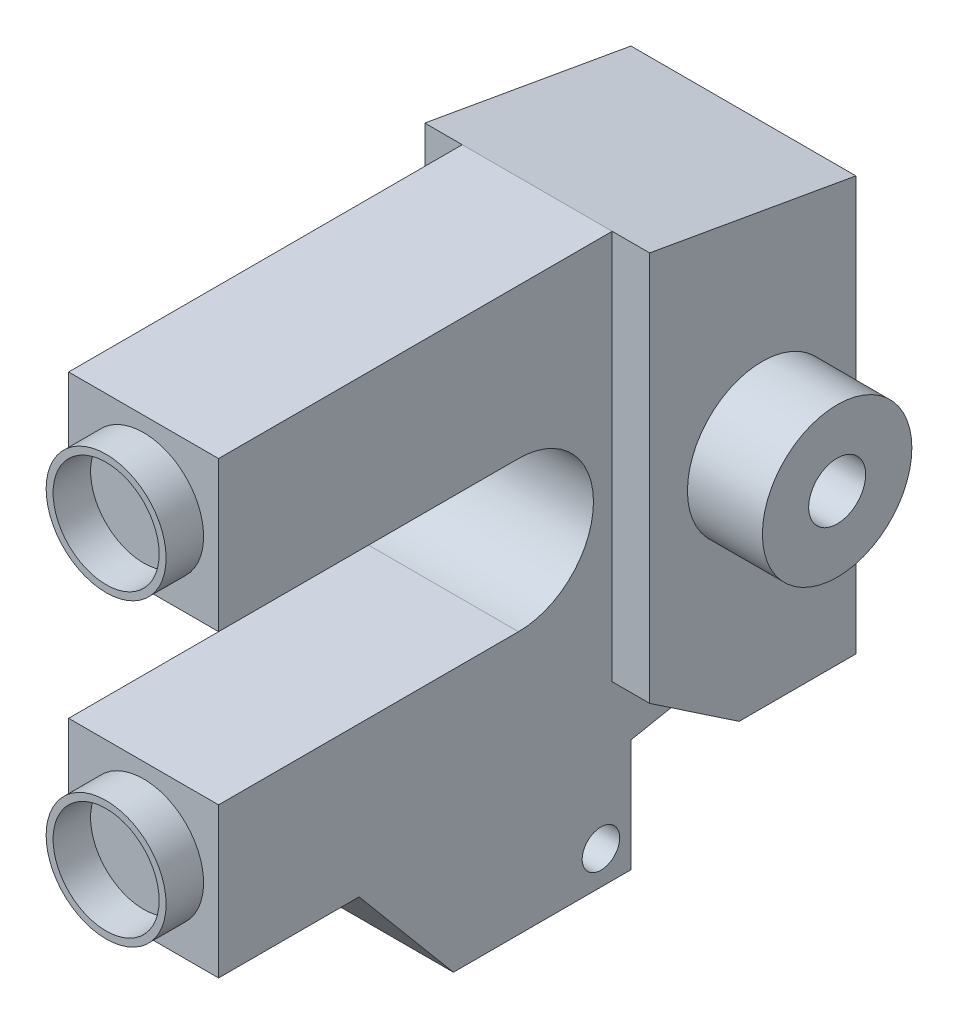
SolidWorks part; units mm, degrees
ref_plane "Front" through (0, 0, 0) normal (0, 0, 1) x (1, 0, 0)
ref_plane "Top" through (0, 0, 0) normal (0, 1, 0) x (1, 0, 0)
ref_plane "Right" through (0, 0, 0) normal (1, 0, 0) x (0, 0, -1)
sketch "Sketch1" plane through (0, 0, 0) normal (1, 0, 0) x (0, 0, -1)
  line L0 (0, 0) -> (0, 38.1)
  line L1 (0, 38.1) -> (33.3375, 38.1)
  line L2 (33.3375, 38.1) -> (50.8, 35.0209)
  line L3 (50.8, 35.0209) -> (50.8, 3.0858)
  line L4 (50.8, 3.0858) -> (34.925, 0)
  line L5 (34.925, 0) -> (34.925, -9.525)
  line L6 (34.925, -9.525) -> (19.89, -9.525)
  line L7 (19.89, -9.525) -> (11.8975, 0)
  line L8 (11.8975, 0) -> (0, 0)
  dimension "D1" = 33.3375
  dimension "D2" = 17.4625
  dimension "D3" = 50
  dimension "D4" = 9.525
  dimension "D5" = 34.925
  dimension "D6" = 38.1
  dimension "D7" = 11
  dimension "D8" = 10
  dimension "D9" = 11.8975
extrude "Boss-Extrude1" add sketch "Sketch1" along normal mid plane 12.7
sketch "Sketch2" plane through (6.35, 0, 0) normal (1, 0, 0) x (0, 0, -1)
  line L0 (0, 19.05) -> (25.4, 19.05) construction
  line L1 (0, 38.1) -> (0, 0) construction
  line L2 (0, 25.4) -> (25.4, 25.4)
  line L3 (0, 12.7) -> (25.4, 12.7)
  line L4 (33.3375, 38.1) -> (0, 38.1) construction
  arc A0 (0, 25.4) -> (0, 12.7) centre (0, 19.05) ccw
  arc A1 (25.4, 12.7) -> (25.4, 25.4) centre (25.4, 19.05) ccw
  point P4 (12.7, 19.05)
  dimension "D2" = 9.525
  dimension "D1" = 12.7
extrude "Cut-Extrude1" cut sketch "Sketch2" against normal through all
ref_plane "Plane1" through (6.35, 0, 0) normal (1, 0, 0) x (0, 0, -1)
sketch "Sketch3" plane through (6.35, 0, 0) normal (1, 0, 0) x (0, 0, -1)
  line L0 (33.3375, 38.1) -> (33.3375, 5.0603)
  line L1 (33.3375, 5.0603) -> (40.9066, -0.0452)
  line L2 (40.9066, -0.0452) -> (50.8, -0.0452)
  line L3 (50.8, 35.0209) -> (50.8, -0.0452)
  line L9 (33.3375, 38.1) -> (50.8, 35.0209)
  line L11 (33.3375, 38.1) -> (0, 38.1) construction
  line L12 (50.8, 3.0858) -> (50.8, 35.0209) construction
  line L13 (-967.616, -7.0741) -> (33.9715, -7.0741) construction
  line L15 (99.3934, -7.0741) -> (106.2938, -7.0741) construction
  circle A2 centre (32.384, -7.0741) radius 1.5875 construction
  circle A3 centre (102.8436, -6.698) radius 3.4706 construction
  point P18 (50.8, 25.4)
  point P21 (100.6665, 6.002)
  dimension "D6" = 34
  dimension "D3" = 10
  dimension "D4" = 40.9066
  dimension "D13" = 3.175
  dimension "D10" = 6.9412
  dimension "D9" = 70.4596
extrude "Boss-Extrude2" add sketch "Sketch3" along normal blind 3.175
sketch "Sketch4" plane through (9.525, 0, 0) normal (1, 0, 0) x (0, 0, -1)
  circle A0 centre (42.8625, 19.05) radius 6.3287
  dimension "D2" = 12.6574
  dimension "D1" = 17.4625
extrude "Boss-Extrude3" add sketch "Sketch4" along normal blind 6.35
ref_plane "Plane2" through (0, 0, 0) normal (-1, 0, 0) x (0, 0, 1)
mirror "Mirror1" about plane through (0, 0, 0) normal (-1, 0, 0) of "Boss-Extrude2"
sketch "Sketch8" plane through (-9.525, 0, 0) normal (-1, 0, 0) x (0, 0, 1)
  circle A0 centre (-42.8625, 19.05) radius 6.35
  dimension "D1" = 12.7
extrude "Boss-Extrude5" add sketch "Sketch8" along normal blind 6.35
sketch "Sketch9" plane through (-15.875, 0, 0) normal (-1, 0, 0) x (0, 0, 1)
  circle A0 centre (-42.8625, 19.05) radius 2.413
  dimension "D1" = 4.826
extrude "Cut-Extrude4" cut sketch "Sketch9" against normal through all
sketch "Sketch12" plane through (0, -9.525, 0) normal (0, -1, 0) x (1, 0, 0)
  line L0 (6.35, -34.925) -> (-6.35, -34.925) construction
  line L1 (-3.175, -34.925) -> (3.175, -34.925)
  line L2 (-3.175, -34.925) -> (-3.175, -22.225)
  line L3 (-3.175, -22.225) -> (3.175, -22.225)
  line L4 (3.175, -34.925) -> (3.175, -22.225)
  line L5 (-3.175, -34.925) -> (3.175, -22.225) construction
  line L6 (-3.175, -22.225) -> (3.175, -34.925) construction
  point P0 (0, -28.575)
  dimension "D1" = 12.7
  dimension "D2" = 6.35
  dimension "D3" = 0
extrude "Cut-Extrude5" cut sketch "Sketch12" against normal blind 11.1125
sketch "Sketch14" plane through (6.35, 0, 0) normal (1, 0, 0) x (0, 0, -1)
  line L0 (34.925, -9.525) -> (34.925, 0) construction
  line L2 (19.89, -9.525) -> (34.925, -9.525) construction
  circle A0 centre (32.384, -6.698) radius 1.5875
  dimension "D2" = 3.175
  dimension "D3" = 2.827
  dimension "D1" = 2.541
extrude "Cut-Extrude6" cut sketch "Sketch14" against normal through all
sketch "Sketch15" plane through (0, 0, 0) normal (0, 0, 1) x (1, 0, 0)
  line L0 (6.35, 38.1) -> (6.35, 25.4) construction
  line L1 (-6.35, 25.4) -> (6.35, 25.4) construction
  circle A0 centre (0, 31.75) radius 4.4907
  circle A1 centre (0, 31.75) radius 5.08
  dimension "D1" = 8.9814
  dimension "D2" = 10.16
  dimension "D4" = 6.35
  dimension "D3" = 6.35
extrude "Boss-Extrude6" add sketch "Sketch15" along normal blind 3.175
sketch "Sketch16" plane through (0, 0, 0) normal (0, 0, 1) x (1, 0, 0)
  line L0 (6.35, 0) -> (-6.35, 0) construction
  line L1 (-6.35, 12.7) -> (-6.35, 0) construction
  circle A0 centre (0, 6.35) radius 4.4907
  circle A1 centre (0, 6.35) radius 5.08
  dimension "D1" = 8.9814
  dimension "D2" = 10.16
  dimension "D3" = 6.35
  dimension "D4" = 6.35
extrude "Boss-Extrude7" add sketch "Sketch16" along normal blind 3.175
